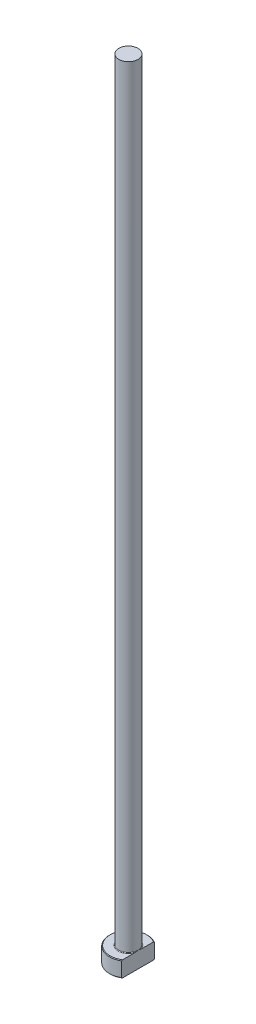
SolidWorks part; units mm, degrees
ref_plane "Front Plane" through (0, 0, 0) normal (0, 0, 1) x (1, 0, 0)
ref_plane "Top Plane" through (0, 0, 0) normal (0, 1, 0) x (1, 0, 0)
ref_plane "Right Plane" through (0, 0, 0) normal (1, 0, 0) x (0, 0, -1)
sketch "Sketch1" plane through (0, 0, 0) normal (0, 0, 1) x (1, 0, 0)
  line L0 (0, 259.9588) -> (0, -15.1925) construction
  line L1 (0, 0) -> (-6, 0)
  line L2 (-6, 0) -> (-6, 5)
  line L3 (-6, 5) -> (-3.05, 5)
  line L4 (-3.05, 5) -> (-3.05, 250)
  line L5 (-3.05, 250) -> (0, 250)
  line L6 (0, 250) -> (0, 0)
  dimension "L" = 250
  dimension "H" = 12
  dimension "T" = 5
  dimension "D" = 6.1
revolve "Revolve1" add sketch "Sketch1" angle 360 about L0
chamfer "Chamfer1" distance 0.2 angle 45 2 edges at (0, 5, 6) (0, 0, 6)
fillet "Fillet1" radius 0.2 1 edges at (0, 5, 3.05)
sketch "Sketch2" plane through (0, 0, 0) normal (0, 1, 0) x (1, 0, 0)
  line L0 (3.05, 5.167) -> (3.05, -5.167)
  circle A0 centre (0, 0) radius 6 construction
  arc A1 (3.05, -5.167) -> (3.05, 5.167) centre (0, 0) ccw
  circle A2 centre (0, 0) radius 3.05 construction
extrude "KEY" cut sketch "Sketch2" along normal through all
